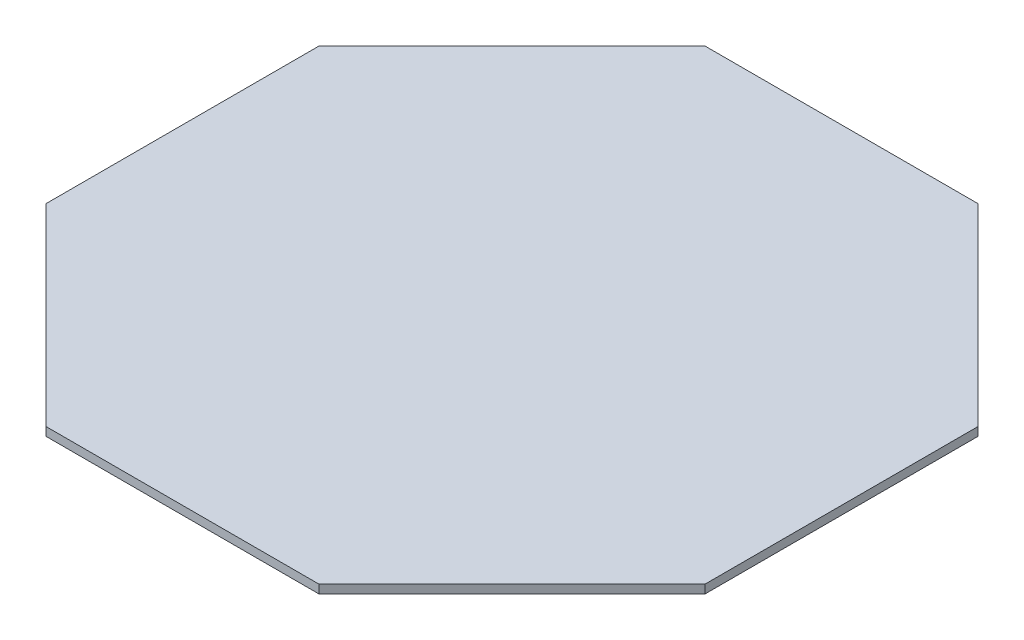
SolidWorks part; units mm, degrees
ref_plane "Front Plane" through (0, 0, 0) normal (0, 0, 1) x (1, 0, 0)
ref_plane "Top Plane" through (0, 0, 0) normal (0, 1, 0) x (1, 0, 0)
ref_plane "Right Plane" through (0, 0, 0) normal (1, 0, 0) x (0, 0, -1)
sketch "Sketch1" plane through (0, 0, 0) normal (0, 1, 0) x (1, 0, 0)
  line L1 (76.2, -183.9631) -> (183.9631, -76.2)
  line L2 (183.9631, -76.2) -> (183.9631, 76.2)
  line L3 (183.9631, 76.2) -> (76.2, 183.9631)
  line L4 (76.2, 183.9631) -> (-76.2, 183.9631)
  line L5 (-76.2, 183.9631) -> (-183.9631, 76.2)
  line L6 (-183.9631, 76.2) -> (-183.9631, -76.2)
  line L7 (-183.9631, -76.2) -> (-76.2, -183.9631)
  line L8 (-76.2, -183.9631) -> (76.2, -183.9631)
  circle A0 centre (0, 0) radius 183.9631 construction
  point P1 (0, 183.9631)
  dimension "D1" = 152.4
extrude "Boss-Extrude1" add sketch "Sketch1" along normal blind 4.7625
